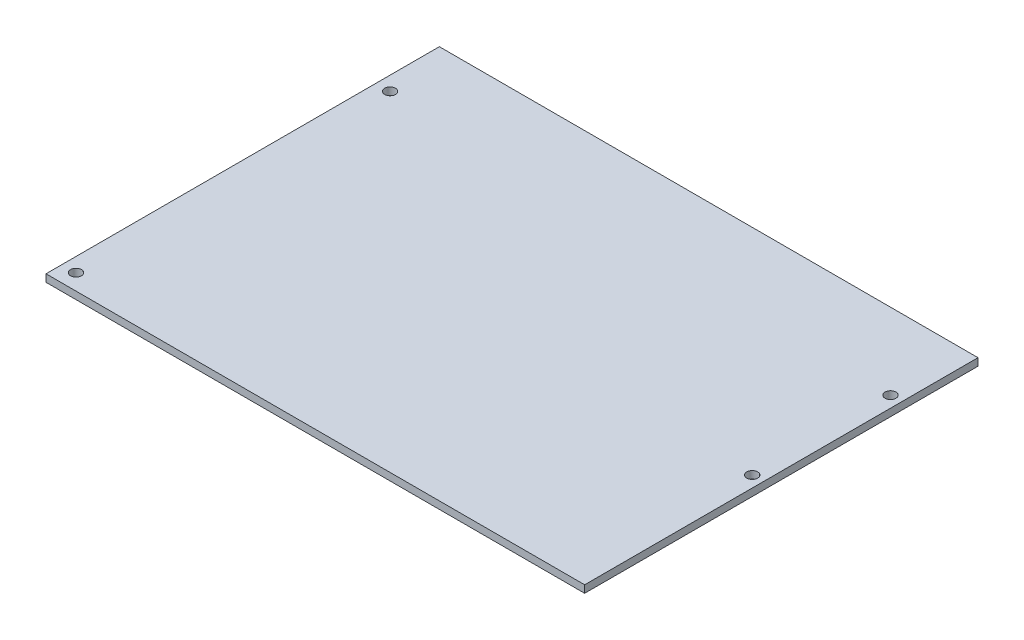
SolidWorks part; units mm, degrees
ref_plane "Front Plane" through (0, 0, 0) normal (0, 0, 1) x (1, 0, 0)
ref_plane "Top Plane" through (0, 0, 0) normal (0, 1, 0) x (1, 0, 0)
ref_plane "Right Plane" through (0, 0, 0) normal (1, 0, 0) x (0, 0, -1)
sketch "Sketch1" plane through (0, 0, 0) normal (0, 1, 0) x (1, 0, 0)
  line L0 (0, 92.5957) -> (0, 106.5657)
  line L1 (0, 0) -> (145.9357, 0)
  line L2 (0, 0) -> (0, 92.5957)
  line L3 (0, 92.5957) -> (145.9357, 92.5957) construction
  line L4 (145.9357, 0) -> (145.9357, 92.5957)
  line L5 (0, 106.5657) -> (145.9357, 106.5657)
  line L6 (145.9357, 106.5657) -> (145.9357, 92.5957)
  circle A0 centre (3.81, 89.408) radius 1.4732
  circle A1 centre (3.81, 4.318) radius 1.4732
  circle A2 centre (142.875, 85.9155) radius 1.4732
  circle A3 centre (142.875, 48.4505) radius 1.4732
  dimension "D3" = 2.9464
  dimension "D1" = 145.9357
  dimension "D2" = 92.5957
  dimension "D4" = 3.81
  dimension "D5" = 89.408
  dimension "D6" = 4.318
  dimension "D7" = 142.875
  dimension "D8" = 85.9155
  dimension "D9" = 48.4505
  dimension "D10" = 13.97
extrude "Extrude1" add sketch "Sketch1" along normal blind 2.0066
